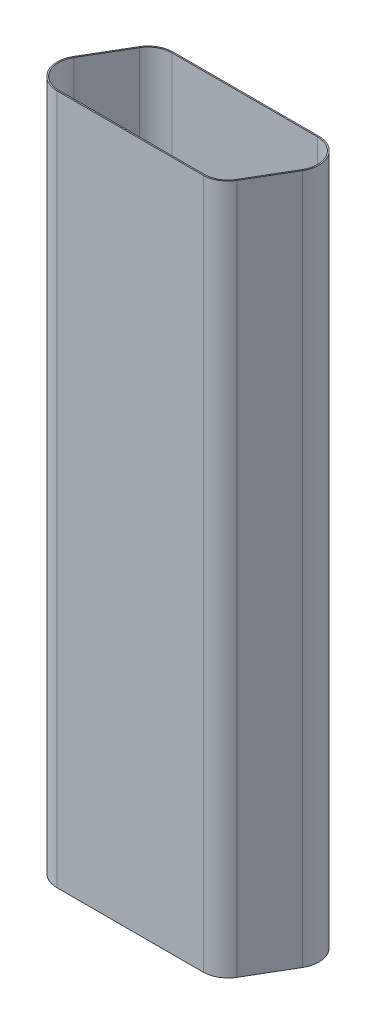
SolidWorks part; units mm, degrees
ref_plane "Front" through (0, 0, 0) normal (0, 0, 1) x (1, 0, 0)
ref_plane "Top" through (0, 0, 0) normal (0, 1, 0) x (1, 0, 0)
ref_plane "Right" through (0, 0, 0) normal (1, 0, 0) x (0, 0, -1)
sketch "Sketch1" plane through (0, 0, 0) normal (0, 1, 0) x (-1, 0, 0)
  line L0 (-64.75, -24.8571) -> (-9.25, -24.8571)
  line L1 (-72.6161, -11.1071) -> (-63.3661, 4.625)
  line L2 (-1.3839, -20.3571) -> (7.8661, -4.625)
  line L3 (-73.0321, -10.8625) -> (-63.7821, 4.8696)
  line L4 (0, 9.125) -> (-55.5, 9.125)
  line L5 (-55.6829, 9.6059) -> (0.155, 9.6064)
  line L6 (9.6076, 0) -> (9.6076, -26.4286) construction
  line L7 (-74.3576, -15.7321) -> (-74.3576, 8.5544) construction
  line L8 (9.6076, -7.8661) -> (-74.3576, -7.8661) construction
  line L9 (-32.375, -7.8661) -> (-32.375, 20.581) construction
  line L10 (-0.9679, -20.6017) -> (8.2821, -4.8696)
  line L11 (-64.75, -25.3397) -> (-9.25, -25.3397)
  line L12 (-31.8824, 30.3654) -> (-1517.9605, 1081.4132) construction
  line L13 (-31.1027, 30.4051) -> (-573.5187, 414.0357) construction
  line L14 (-31.1027, 30.4051) -> (-55.5, 9.125) construction
  line L15 (-31.8824, 30.3654) -> (-55.6829, 9.6059) construction
  line L16 (-573.5187, 414.0357) -> (0, 9.125) construction
  line L17 (-1517.9605, 1081.4132) -> (0.155, 9.6064) construction
  line L18 (-42.0407, -24.8571) -> (-42.0407, 9.125) construction
  arc A0 (-63.7821, 4.8696) -> (-55.6829, 9.6059) centre (-55.5, 0) cw
  arc A1 (8.2821, -4.8696) -> (0.155, 9.6064) centre (0, 0) ccw
  arc A2 (-63.3661, 4.625) -> (-55.5, 9.125) centre (-55.5, 0) cw
  arc A3 (7.8661, -4.625) -> (0, 9.125) centre (0, 0) ccw
  arc A7 (-72.6161, -11.1071) -> (-64.75, -24.8571) centre (-64.75, -15.7321) ccw construction
  arc A8 (-72.6161, -11.1071) -> (-64.75, -24.8571) centre (-64.75, -15.7321) ccw
  arc A9 (-9.25, -24.8571) -> (-1.3839, -20.3571) centre (-9.25, -15.7321) ccw
  arc A10 (-9.25, -25.3397) -> (-0.9679, -20.6017) centre (-9.25, -15.7321) ccw
  arc A11 (-73.0321, -10.8625) -> (-64.75, -25.3397) centre (-64.75, -15.7321) ccw
  circle A12 centre (-55.5, 0) radius 9.125 construction
  circle A13 centre (-64.75, -15.7321) radius 9.125 construction
  arc A14 (-9.25, -24.8571) -> (-1.3839, -20.3571) centre (-9.25, -15.7321) ccw construction
  arc A15 (8.2821, -4.8696) -> (0.155, 9.6064) centre (0, 0) ccw construction
  circle A16 centre (-9.25, -15.7321) radius 9.125 construction
  circle A17 centre (0, 0) radius 9.125 construction
  point P47 (-42.0407, -7.8661)
  dimension "D1" = 0.4826
extrude "Boss-Extrude1" add sketch "Sketch1" along normal up to surface (199.5 mm away)
ref_plane "Plane1" through (0, 0, -7.8661) normal (0, 0, -1) x (-1, 0, 0)
